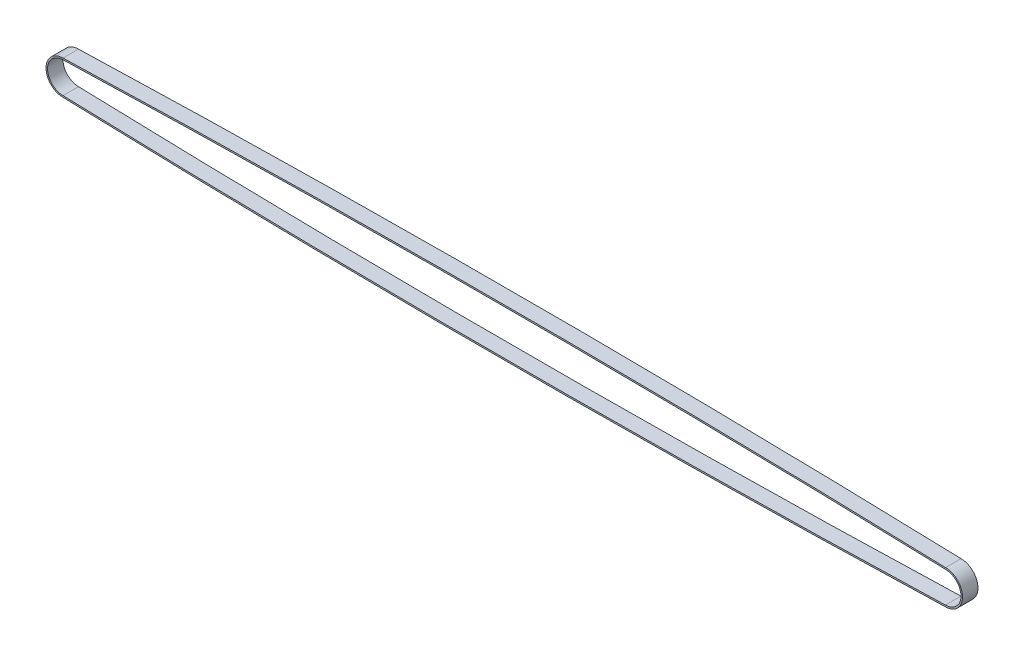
SolidWorks part; units mm, degrees
ref_plane "Front Plane" through (0, 0, 0) normal (0, 0, 1) x (1, 0, 0)
ref_plane "Top Plane" through (0, 0, 0) normal (0, 1, 0) x (1, 0, 0)
ref_plane "Right Plane" through (0, 0, 0) normal (1, 0, 0) x (0, 0, -1)
sketch "Sketch1" plane through (0, 0, 0) normal (0, 0, 1) x (1, 0, 0)
  line L0 (1447.8, 0) -> (0, 0) construction
  line L1 (1447.8, 0) -> (1447.8, -50.8) construction
  line L2 (0, -50.8) -> (1447.8, -50.8) construction
  line L3 (0, -50.8) -> (0, 0) construction
  arc A0 (1447.8, -50.8) -> (1447.8, 0) centre (1447.8, -25.4) ccw
  arc A1 (0, -50.8) -> (0, 0) centre (0, -25.4) cw
  arc A2 (0, 0) -> (1447.8, 0) centre (723.9, -22848.5354) cw
  arc A3 (0, -50.8) -> (1447.8, -50.8) centre (723.9, 22797.7354) ccw
  arc A4 (-0.0412, 2.54) -> (1447.8412, 2.54) centre (723.9, -22848.5354) cw
  arc A5 (1447.8412, -53.34) -> (1447.8412, 2.54) centre (1447.8, -25.4) ccw
  arc A6 (-0.0412, -53.34) -> (1447.8412, -53.34) centre (723.9, 22797.7354) ccw
  arc A7 (-0.0412, -53.34) -> (-0.0412, 2.54) centre (0, -25.4) cw
  dimension "D3" = 22860
  dimension "D4" = 22860
  dimension "D1" = 1447.8
  dimension "D2" = 50.8
  dimension "D5" = 2.54
extrude "Boss-Extrude1" add sketch "Sketch1" along normal blind 25.4
